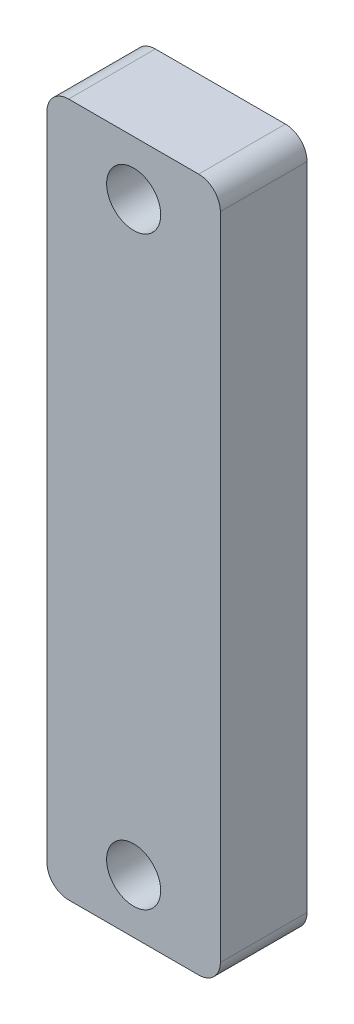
SolidWorks part; units mm, degrees
ref_plane "Front Plane" through (0, 0, 0) normal (0, 0, 1) x (1, 0, 0)
ref_plane "Top Plane" through (0, 0, 0) normal (0, 1, 0) x (1, 0, 0)
ref_plane "Right Plane" through (0, 0, 0) normal (1, 0, 0) x (0, 0, -1)
sketch "Sketch1" plane through (0, 0, 0) normal (0, 0, 1) x (1, 0, 0)
  line L0 (0, 0) -> (25.4, 0)
  line L1 (25.4, 0) -> (25.4, 101.6)
  line L2 (25.4, 101.6) -> (0, 101.6)
  line L3 (0, 101.6) -> (0, 0)
  circle A0 centre (12.7, 7.9248) radius 3.9624
  circle A1 centre (12.7, 93.6498) radius 3.9624
  dimension "D3" = 7.9248
  dimension "D1" = 25.4
  dimension "D2" = 101.6
  dimension "D4" = 7.9248
  dimension "D5" = 85.725
  dimension "D6" = 12.7
extrude "Boss-Extrude1" add sketch "Sketch1" along normal blind 12.7
fillet "Fillet1" radius 3.175 4 edges at (25.4, 0, 6.35) (0, 0, 6.35) (0, 101.6, 6.35) (25.4, 101.6, 6.35)
